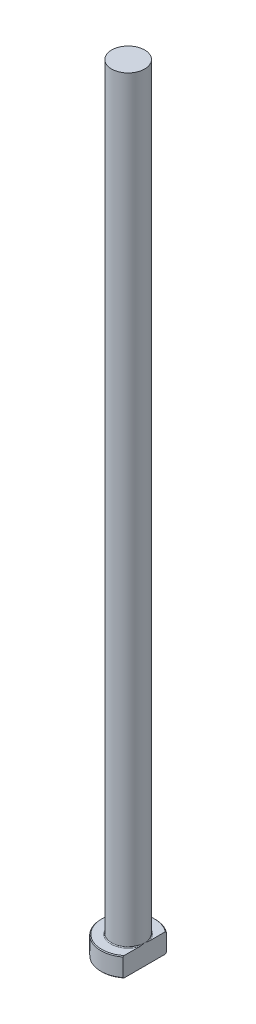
SolidWorks part; units mm, degrees
ref_plane "Front Plane" through (0, 0, 0) normal (0, 0, 1) x (1, 0, 0)
ref_plane "Top Plane" through (0, 0, 0) normal (0, 1, 0) x (1, 0, 0)
ref_plane "Right Plane" through (0, 0, 0) normal (1, 0, 0) x (0, 0, -1)
sketch "Sketch1" plane through (0, 0, 0) normal (0, 0, 1) x (1, 0, 0)
  line L0 (0, 259.9588) -> (0, -15.1925) construction
  line L1 (0, 0) -> (-7, 0)
  line L2 (-7, 0) -> (-7, 5)
  line L3 (-7, 5) -> (-4.25, 5)
  line L4 (-4.25, 5) -> (-4.25, 200)
  line L5 (-4.25, 200) -> (0, 200)
  line L6 (0, 200) -> (0, 0)
  dimension "L" = 200
  dimension "H" = 14
  dimension "T" = 5
  dimension "D" = 8.5
revolve "Revolve1" add sketch "Sketch1" angle 360 about L0
chamfer "Chamfer1" distance 0.2 angle 45 2 edges at (0, 5, 7) (0, 0, 7)
fillet "Fillet1" radius 0.2 1 edges at (0, 5, 4.25)
sketch "Sketch2" plane through (0, 0, 0) normal (0, 1, 0) x (1, 0, 0)
  line L0 (4.25, 5.5621) -> (4.25, -5.5621)
  circle A0 centre (0, 0) radius 7 construction
  arc A1 (4.25, -5.5621) -> (4.25, 5.5621) centre (0, 0) ccw
  circle A2 centre (0, 0) radius 4.25 construction
extrude "KEY" cut sketch "Sketch2" along normal through all
